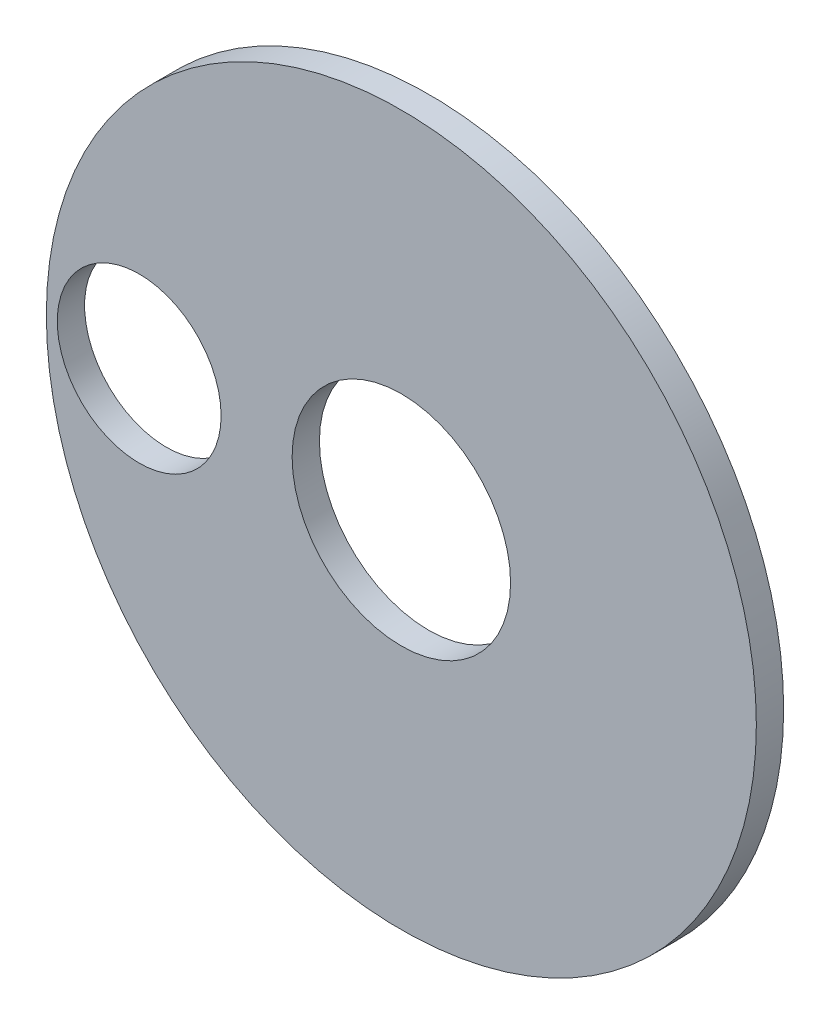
SolidWorks part; units mm, degrees
ref_plane "Front Plane" through (0, 0, 0) normal (0, 0, 1) x (1, 0, 0)
ref_plane "Top Plane" through (0, 0, 0) normal (0, 1, 0) x (1, 0, 0)
ref_plane "Right Plane" through (0, 0, 0) normal (1, 0, 0) x (0, 0, -1)
sketch "Sketch1" plane through (0, 0, 0) normal (0, 0, 1) x (1, 0, 0)
  circle A0 centre (0, 0) radius 20.6375
  circle A1 centre (0, 0) radius 6.35
  circle A2 centre (-15.24, 0) radius 4.7625
  dimension "D1" = 41.275
  dimension "D2" = 12.7
  dimension "D4" = 9.525
  dimension "D3" = 15.24
extrude "Extrude1" add sketch "Sketch1" along normal blind 1.5875
